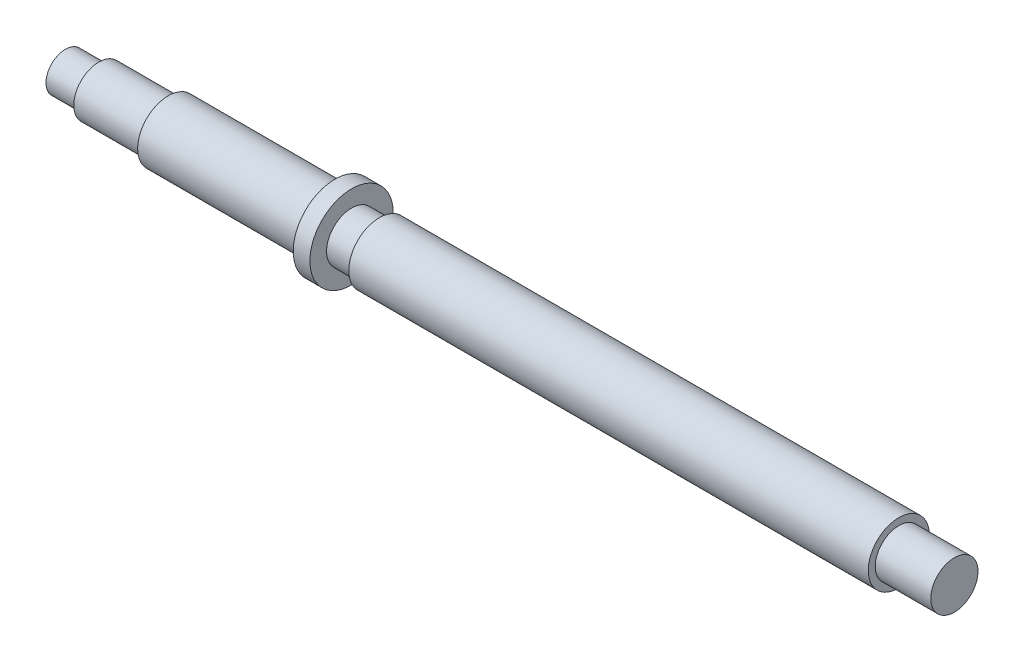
SolidWorks part; units mm, degrees
ref_plane "Front Plane" through (0, 0, 0) normal (0, 0, 1) x (1, 0, 0)
ref_plane "Top Plane" through (0, 0, 0) normal (0, 1, 0) x (1, 0, 0)
ref_plane "Right Plane" through (0, 0, 0) normal (1, 0, 0) x (0, 0, -1)
sketch "Sketch1" plane through (0, 0, 0) normal (0, 0, 1) x (1, 0, 0)
  line L0 (0, 0) -> (160, 0)
  line L1 (160, 0) -> (160, 4.25)
  line L2 (160, 4.25) -> (150, 4.25)
  line L3 (150, 4.25) -> (150, 5.5)
  line L4 (150, 5.5) -> (56.5, 5.5)
  line L5 (6, 4.5) -> (6, 3.5)
  line L6 (6, 3.5) -> (0, 3.5)
  line L7 (0, 3.5) -> (0, 0)
  line L8 (160, 0) -> (164.7589, 0) construction
  line L9 (18.5, 4.5) -> (18.5, 5.5)
  line L10 (18.5, 5.5) -> (48.5, 5.5)
  line L11 (51.5, 4.5) -> (56.5, 4.5)
  line L12 (18.5, 4.5) -> (6, 4.5)
  line L13 (48.5, 5.5) -> (48.5, 7.5)
  line L14 (48.5, 7.5) -> (51.5, 7.5)
  line L15 (51.5, 7.5) -> (51.5, 4.5)
  line L16 (56.5, 4.5) -> (56.5, 5.5)
  dimension "D1" = 160
  dimension "D2" = 7
  dimension "D3" = 11
  dimension "D4" = 8.5
  dimension "D5" = 6
  dimension "D6" = 11
  dimension "D7" = 15
  dimension "D8" = 9
  dimension "D9" = 12.5
  dimension "D10" = 3
  dimension "D11" = 5
  dimension "D12" = 30
  dimension "D13" = 9
  dimension "D14" = 10
revolve "Revolve1" add sketch "Sketch1" angle 360 about L8
